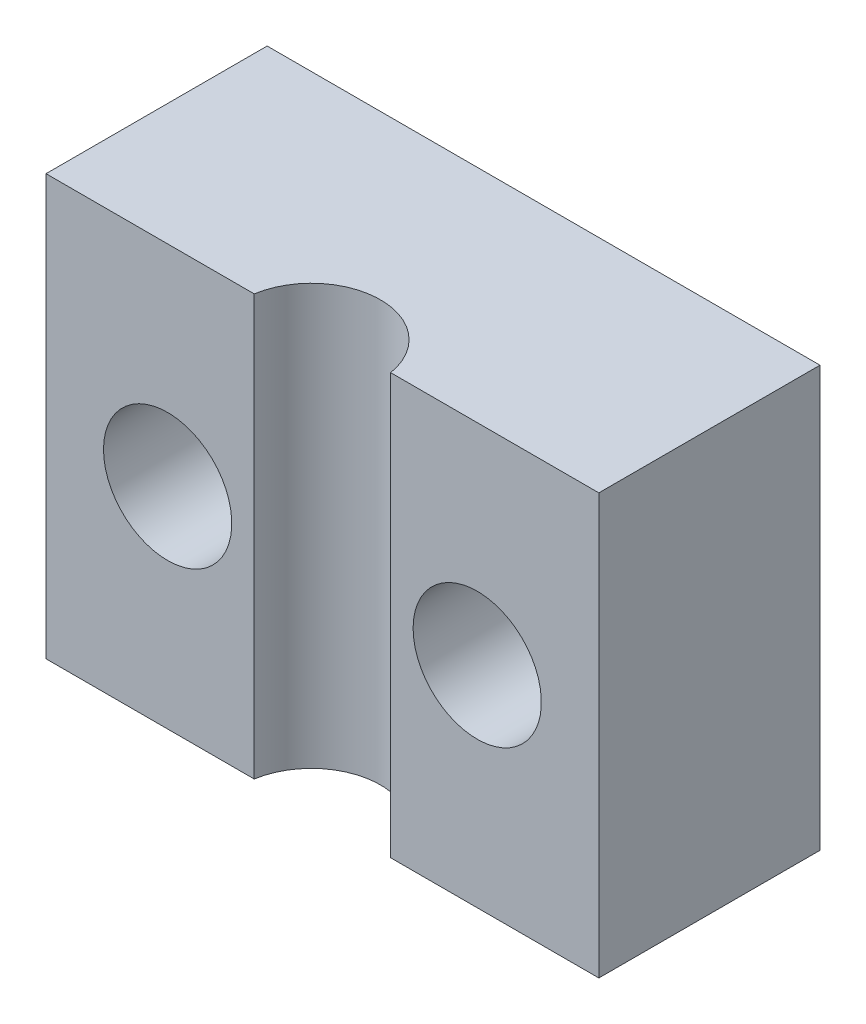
SolidWorks part; units mm, degrees
ref_plane "Front Plane" through (0, 0, 0) normal (0, 0, 1) x (1, 0, 0)
ref_plane "Top Plane" through (0, 0, 0) normal (0, 1, 0) x (1, 0, 0)
ref_plane "Right Plane" through (0, 0, 0) normal (1, 0, 0) x (0, 0, -1)
sketch "Sketch1" plane through (0, 0, 0) normal (0, 1, 0) x (1, 0, 0)
  line L0 (0, 0) -> (4.783, 0)
  line L1 (7.917, 0) -> (12.7, 0)
  line L2 (0, 0) -> (0, 5.08)
  line L3 (0, 5.08) -> (12.7, 5.08)
  line L4 (12.7, 0) -> (12.7, 5.08)
  arc A0 (7.917, 0) -> (4.783, 0) centre (6.35, -0.254) ccw
  dimension "D1" = 5.08
extrude "Extrude1" add sketch "Sketch1" along normal blind 9.652
sketch "Sketch2" plane through (0, 0, -5.08) normal (0, 0, -1) x (-1, 0, 0)
  circle A0 centre (-9.906, 4.826) radius 1.4732
  circle A1 centre (-2.794, 4.826) radius 1.4732
extrude "Cut-Extrude1" cut sketch "Sketch2" against normal through all
